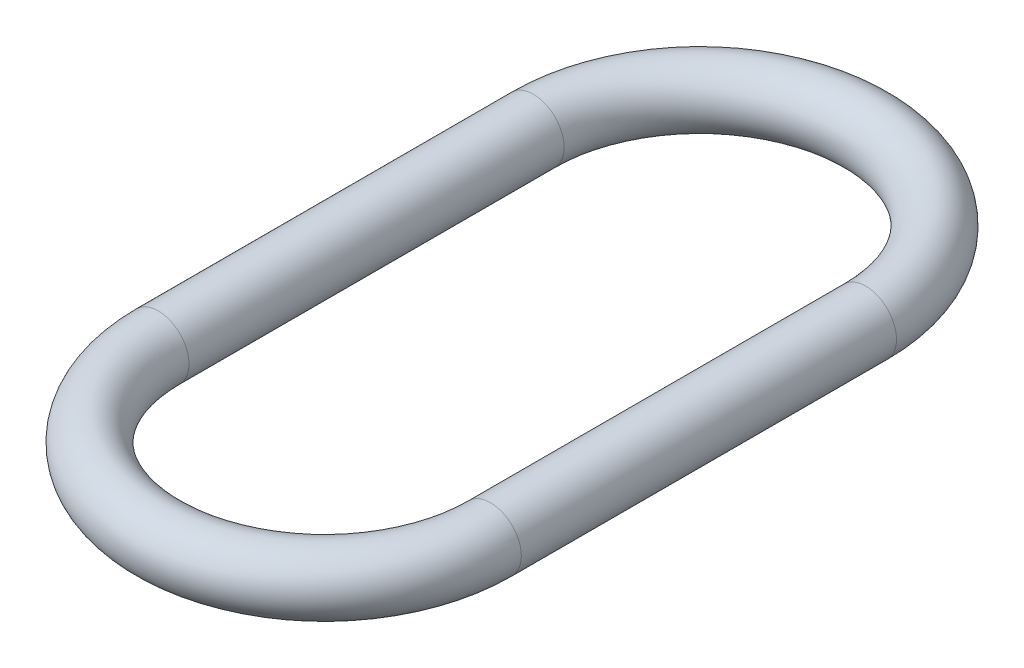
SolidWorks part; units mm, degrees
ref_plane "Front" through (0, 0, 0) normal (0, 0, 1) x (1, 0, 0)
ref_plane "Top" through (0, 0, 0) normal (0, 1, 0) x (1, 0, 0)
ref_plane "Right" through (0, 0, 0) normal (1, 0, 0) x (0, 0, -1)
sketch "Sketch7" plane through (0, 0, 0) normal (0, -1, 0) x (0, 0, -1)
  line L1 (0, 0) -> (-282.424, 0)
  line L3 (0, -250.1777) -> (-282.424, -250.1777)
  arc A0 (-282.424, 0) -> (-282.424, -250.1777) centre (-282.424, -125.0888) ccw
  arc A1 (0, -250.1777) -> (0, 0) centre (0, -125.0888) ccw
sketch "Sketch8" plane through (0, 0, 0) normal (0, 0, 1) x (1, 0, 0)
  circle A0 centre (0, 0) radius 23.1525
surface "Surface-Sweep5"
